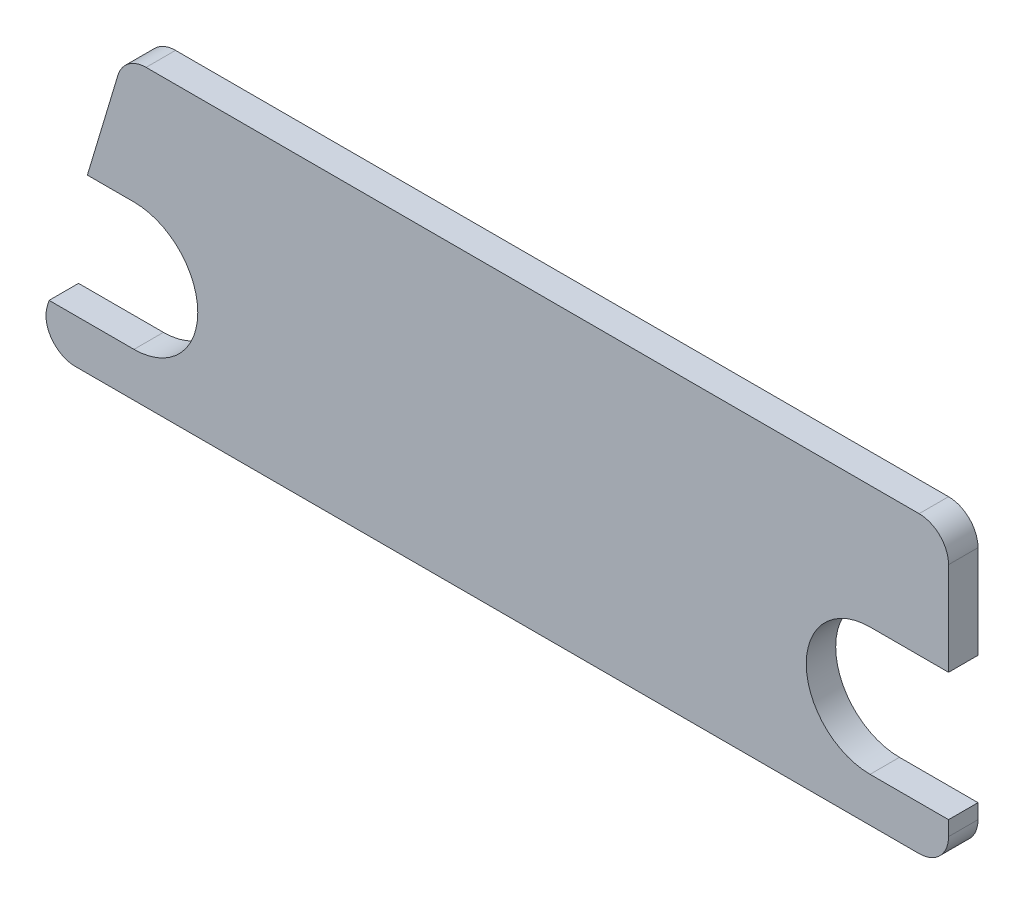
SolidWorks part; units mm, degrees
ref_plane "Plan1" through (0, 0, 0) normal (0, 0, 1) x (1, 0, 0)
ref_plane "Plan2" through (0, 0, 0) normal (0, 1, 0) x (1, 0, 0)
ref_plane "Plan3" through (0, 0, 0) normal (1, 0, 0) x (0, 0, -1)
sketch "Esquisse1" plane through (0, 0, 0) normal (0, 0, 1) x (1, 0, 0)
  line L0 (-84.6414, 27.862) -> (-87.75, 17.5)
  line L1 (-3, 0) -> (-88.9679, 0)
  line L2 (0, 3) -> (0, 4.5)
  line L3 (-3, 30) -> (-81.7679, 30)
  line L4 (-89.6496, 11) -> (0, 11) construction
  line L5 (-91.65, 4.5) -> (-91.8414, 3.862)
  line L6 (-83, 17.5) -> (-87.75, 17.5)
  line L7 (-83, 4.5) -> (-91.65, 4.5)
  line L8 (-8, 17.5) -> (0, 17.5)
  line L9 (-8, 4.5) -> (0, 4.5)
  line L10 (0, 17.5) -> (0, 27)
  arc A0 (-88.9679, 0) -> (-91.8414, 3.862) centre (-88.9679, 3) cw
  arc A1 (-81.7679, 30) -> (-84.6414, 27.862) centre (-81.7679, 27) ccw
  arc A2 (0, 27) -> (-3, 30) centre (-3, 27) ccw
  arc A3 (0, 3) -> (-3, 0) centre (-3, 3) cw
  arc A4 (-83, 4.5) -> (-83, 17.5) centre (-83, 11) ccw
  arc A5 (-8, 17.5) -> (-8, 4.5) centre (-8, 11) ccw
  point P4 (-93, 0)
  point P8 (-84, 30)
  point P11 (0, 30)
  point P14 (0, 0)
  dimension "D1" = 93
  dimension "D6" = 75
  dimension "D7" = 13
  dimension "D9" = 3
  dimension "D2" = 30
  dimension "D4" = 84
  dimension "D5" = 11
  dimension "D8" = 8
extrude "Base-Extrusion" add sketch "Esquisse1" along normal blind 3
